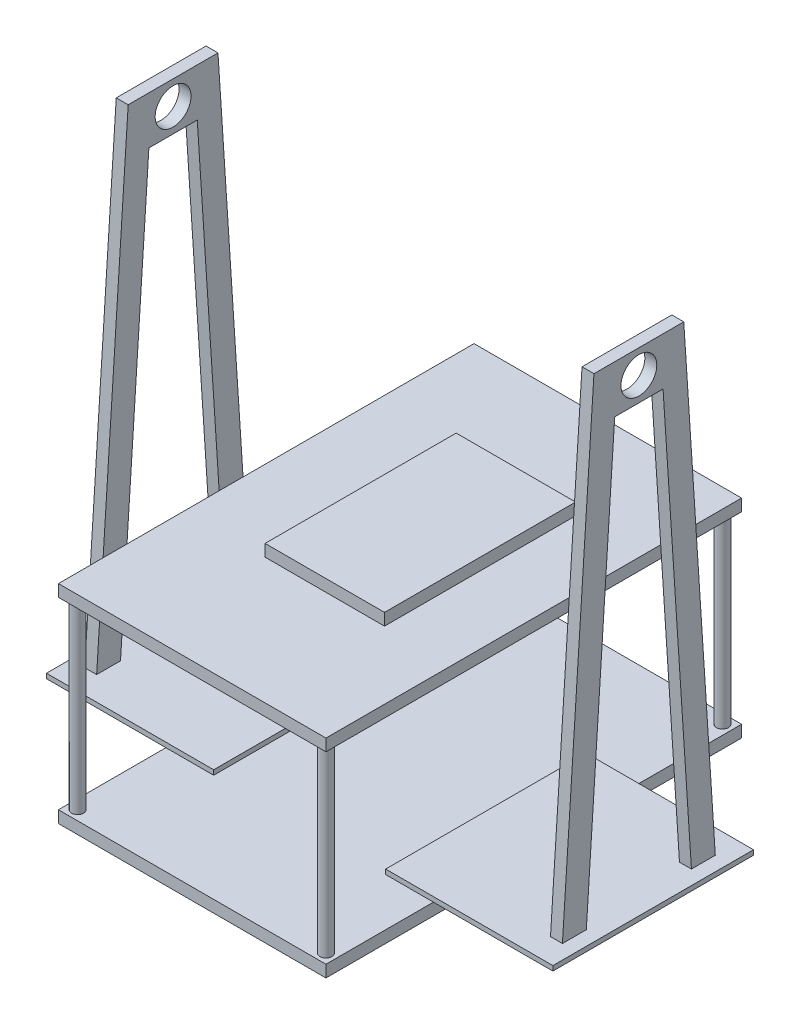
SolidWorks part; units mm, degrees
ref_plane "Front Plane" through (0, 0, 0) normal (0, 0, 1) x (1, 0, 0)
ref_plane "Top Plane" through (0, 0, 0) normal (0, 1, 0) x (1, 0, 0)
ref_plane "Right Plane" through (0, 0, 0) normal (1, 0, 0) x (0, 0, -1)
sketch "Sketch1" plane through (0, 0, 0) normal (0, 0, 1) x (1, 0, 0)
  line L1 (-71.12, -3.175) -> (71.12, -3.175)
  line L2 (-71.12, -3.175) -> (-71.12, 3.175)
  line L3 (-71.12, 3.175) -> (71.12, 3.175)
  line L4 (71.12, -3.175) -> (71.12, 3.175)
  line L5 (-71.12, -3.175) -> (71.12, 3.175) construction
  line L6 (-71.12, 3.175) -> (71.12, -3.175) construction
  point P0 (0, 0)
  dimension "D1" = 142.24
  dimension ".25" = 6.35
extrude "Boss-Extrude1" add sketch "Sketch1" along normal blind 220.98
sketch "Sketch2" plane through (0, 3.175, 0) normal (0, 1, 0) x (1, 0, 0)
  line L0 (71.12, 0) -> (-71.12, 0) construction
  line L1 (-134.62, -57.15) -> (-45.72, -57.15)
  line L2 (-134.62, -57.15) -> (-134.62, -163.83)
  line L3 (-134.62, -163.83) -> (-45.72, -163.83)
  line L4 (-45.72, -57.15) -> (-45.72, -163.83)
  line L5 (71.12, -220.98) -> (-71.12, -220.98) construction
  line L6 (-71.12, -220.98) -> (-71.12, 0) construction
  line L7 (45.72, -57.15) -> (134.62, -57.15)
  line L8 (45.72, -57.15) -> (45.72, -163.83)
  line L9 (45.72, -163.83) -> (134.62, -163.83)
  line L10 (134.62, -57.15) -> (134.62, -163.83)
  line L11 (71.12, -220.98) -> (71.12, 0) construction
  dimension "D1" = 57.15
  dimension "D2" = 57.15
  dimension "D3" = 57.15
  dimension "D4" = 57.15
  dimension "D5" = 25.4
  dimension "D6" = 25.4
  dimension "D7" = 63.5
  dimension "D8" = 63.5
extrude "Boss-Extrude2" add sketch "Sketch2" along normal blind 2.54
sketch "Sketch4" plane through (0, 3.175, 0) normal (0, 1, 0) x (1, 0, 0)
  line L0 (71.12, 0) -> (-71.12, 0) construction
  line L1 (-71.12, -57.15) -> (-71.12, 0) construction
  circle A0 centre (-66.04, -5.08) radius 3.175
  dimension "D1" = 6.35
  dimension "D2" = 5.08
  dimension "D3" = 5.08
extrude "Boss-Extrude3" add sketch "Sketch4" along normal blind 97.79
ref_plane "Plane1" through (0, 0, 110.49) normal (0, 0, 1) x (1, 0, 0)
ref_plane "Plane2" through (0, 0, 0) normal (1, 0, 0) x (0, 0, -1)
mirror "Mirror1" about plane through (0, 0, 0) normal (1, 0, 0) of "Boss-Extrude3"
mirror "Mirror2" about plane through (0, 0, 110.49) normal (0, 0, 1) of "Mirror1", "Boss-Extrude3"
ref_plane "Plane3" through (0, 52.07, 0) normal (0, 1, 0) x (1, 0, 0)
mirror "Mirror3" about plane through (0, 52.07, 0) normal (0, 1, 0) of "Boss-Extrude1"
sketch "Sketch6" plane through (0, 107.315, 0) normal (0, 1, 0) x (1, 0, 0)
  line L1 (-28.3306, -153.8952) -> (35.1694, -153.8952)
  line L2 (-28.3306, -153.8952) -> (-28.3306, -52.2952)
  line L3 (-28.3306, -52.2952) -> (35.1694, -52.2952)
  line L4 (35.1694, -153.8952) -> (35.1694, -52.2952)
  line L5 (-28.3306, -153.8952) -> (35.1694, -52.2952) construction
  line L6 (-28.3306, -52.2952) -> (35.1694, -153.8952) construction
  point P0 (3.4194, -103.0952)
  dimension "D1" = 101.6
  dimension "2.5" = 63.5
extrude "Boss-Extrude4" add sketch "Sketch6" along normal blind 6.35
ref_plane "Plane4" through (-120.65, 0, 0) normal (-1, 0, 0) x (0, 0, 1)
sketch "Sketch12" plane through (-120.65, 0, 0) normal (-1, 0, 0) x (0, 0, 1)
  line L0 (69.85, 5.715) -> (82.55, 5.715)
  line L1 (69.85, 5.715) -> (86.614, 259.715)
  line L2 (57.15, 5.715) -> (163.83, 5.715) construction
  line L3 (57.15, 5.715) -> (57.15, 3.175) construction
  line L4 (110.49, -14.119) -> (110.49, 157.4447) construction
  line L5 (82.55, 5.715) -> (97.6376, 234.315)
  line L6 (123.3424, 234.315) -> (97.6376, 234.315)
  line L7 (86.614, 259.715) -> (134.366, 259.715)
  line L9 (151.13, 5.715) -> (138.43, 5.715)
  line L11 (151.13, 5.715) -> (134.366, 259.715)
  line L12 (138.43, 5.715) -> (123.3424, 234.315)
  dimension "D3" = 228.6
  dimension "D1" = 12.7
  dimension "D2" = 12.7
  dimension "D5" = 254
extrude "Boss-Extrude6" add sketch "Sketch12" along normal blind 6.35 contours L6 L5 L0 L1 L7 L11 L9 L12
sketch "Sketch13" plane through (-127, 0, 0) normal (-1, 0, 0) x (0, 0, 1)
  line L1 (123.3424, 234.315) -> (97.6376, 234.315) construction
  circle A0 centre (110.49, 247.015) radius 9.525
  dimension "D1" = 19.05
  dimension "D2" = 12.7
extrude "Cut-Extrude1" cut sketch "Sketch13" against normal through all both and the other way through all
mirror "Mirror5" about plane through (0, 0, 0) normal (1, 0, 0) of "Boss-Extrude6"
mirror "Mirror6" about plane through (0, 0, 0) normal (1, 0, 0) of "Cut-Extrude1"
